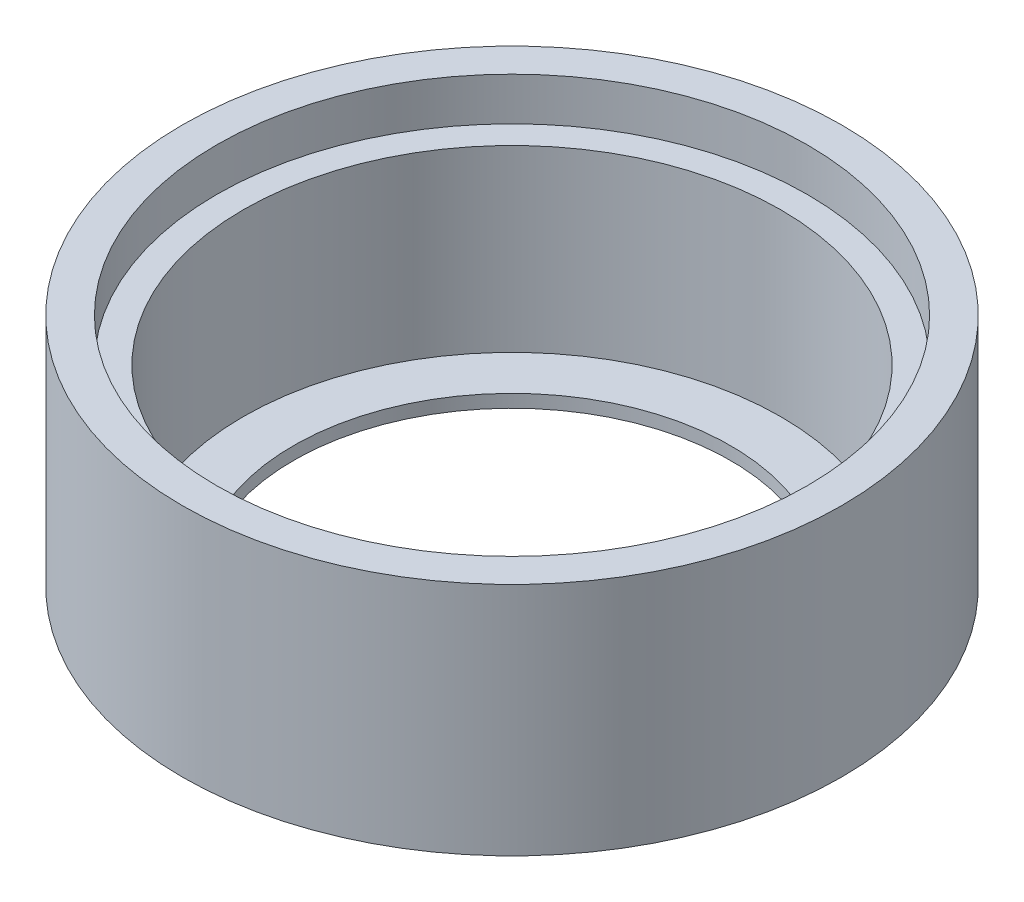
SolidWorks part; units mm, degrees
ref_plane "Front" through (0, 0, 0) normal (0, 0, 1) x (1, 0, 0)
ref_plane "Top" through (0, 0, 0) normal (0, 1, 0) x (1, 0, 0)
ref_plane "Right" through (0, 0, 0) normal (1, 0, 0) x (0, 0, -1)
sketch "Sketch1" plane through (0, 0, 0) normal (0, 1, 0) x (1, 0, 0)
  circle A0 centre (0, 0) radius 5.842
  dimension "D1" = 11.684
extrude "Boss-Extrude1" add sketch "Sketch1" along normal blind 4.1656
sketch "Sketch2" plane through (0, 4.1656, 0) normal (0, 1, 0) x (1, 0, 0)
  circle A0 centre (0, 0) radius 5.2324
  dimension "D1" = 10.4648
extrude "Cut-Extrude1" cut sketch "Sketch2" against normal blind 0.762
sketch "Sketch3" plane through (0, 3.4036, 0) normal (0, 1, 0) x (-1, 0, 0)
  circle A0 centre (0, 0) radius 4.7625
  dimension "D1" = 9.525
extrude "Cut-Extrude2" cut sketch "Sketch3" against normal blind 3.175
sketch "Sketch4" plane through (0, 0.2286, 0) normal (0, 1, 0) x (1, 0, 0)
  circle A0 centre (0, 0) radius 3.8735
  dimension "D1" = 7.747
extrude "Cut-Extrude3" cut sketch "Sketch4" against normal blind 3.175
